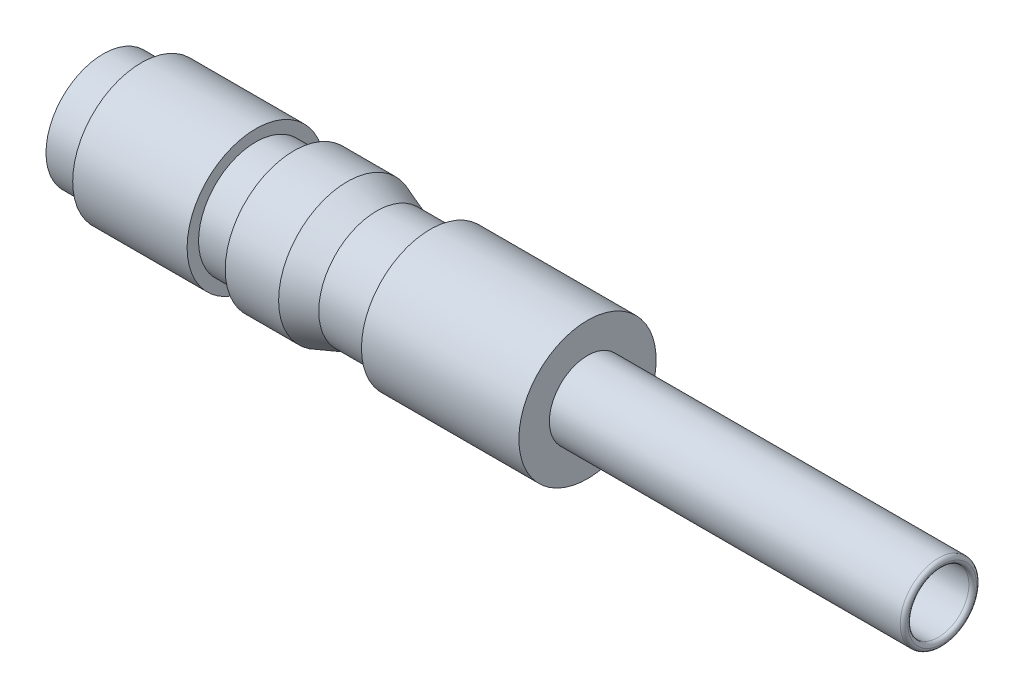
SolidWorks part; units mm, degrees
ref_plane "Plan de face" through (0, 0, 0) normal (0, 0, 1) x (1, 0, 0)
ref_plane "Plan de dessus" through (0, 0, 0) normal (0, 1, 0) x (1, 0, 0)
ref_plane "Plan de droite" through (0, 0, 0) normal (1, 0, 0) x (0, 0, -1)
sketch "Esquisse1" plane through (0, 0, 0) normal (0, 0, 1) x (1, 0, 0)
  line L0 (-4.9975, 0) -> (7.0625, 0) construction
  line L1 (0, 0) -> (0, 0.75)
  line L2 (0, 0.75) -> (0.5, 0.75)
  line L3 (0.5, 0.75) -> (0.5, 0.9)
  line L4 (0.5, 0.9) -> (2, 0.9)
  line L5 (6.35, 0.9) -> (6.35, 0.5)
  line L6 (6.35, 0.5) -> (11, 0.5)
  line L7 (11, 0.5) -> (11, 0)
  line L8 (11, 0) -> (0, 0)
  line L9 (2, 0.9) -> (2, 0.75)
  line L10 (2, 0.75) -> (2.5, 0.75)
  line L11 (2.5, 0.75) -> (2.5, 0.9)
  line L12 (2.5, 0.9) -> (3.2, 0.9)
  line L13 (3.2, 0.9) -> (3.586, 0.7595)
  line L14 (3.586, 0.7595) -> (4.286, 0.7595)
  line L15 (4.286, 0.7595) -> (4.286, 0.9)
  line L16 (4.286, 0.9) -> (6.35, 0.9)
  dimension "D1" = 0.75
  dimension "D2" = 1.5
  dimension "D3" = 0.5
  dimension "D4" = 0.5
  dimension "D5" = 4.65
  dimension "D6" = 11
  dimension "D7" = 0.5
  dimension "D8" = 0.7
  dimension "D9" = 0.7
  dimension "D10" = 2.064
  dimension "D11" = 160
  dimension "D12" = 0.9
  dimension "D13" = 0.75
  dimension "D14" = 0.9
  dimension "D15" = 0.9
revolve "Révolution1" add sketch "Esquisse1" angle 360 about L0
sketch "Esquisse2" plane through (11, 0, 0) normal (1, 0, 0) x (0, 0, -1)
  circle A0 centre (0, 0) radius 0.4
  dimension "D1" = 0.8
extrude "Enlèv. mat.-Extru.1" cut sketch "Esquisse2" against normal blind 6
sketch "Esquisse5" plane through (0, 0, 0) normal (-1, 0, 0) x (0, 0, 1)
  circle A0 centre (0, 0) radius 0.6
  dimension "D1" = 1.2
extrude "Enlèv. mat.-Extru.3" cut sketch "Esquisse5" against normal blind 6
fillet "Congé10" radius 0.05 2 edges at (11, 0, -0.4) (11, 0, 0.5)
fillet "Congé7" radius 0.05
fillet "Congé8" radius 0.05
